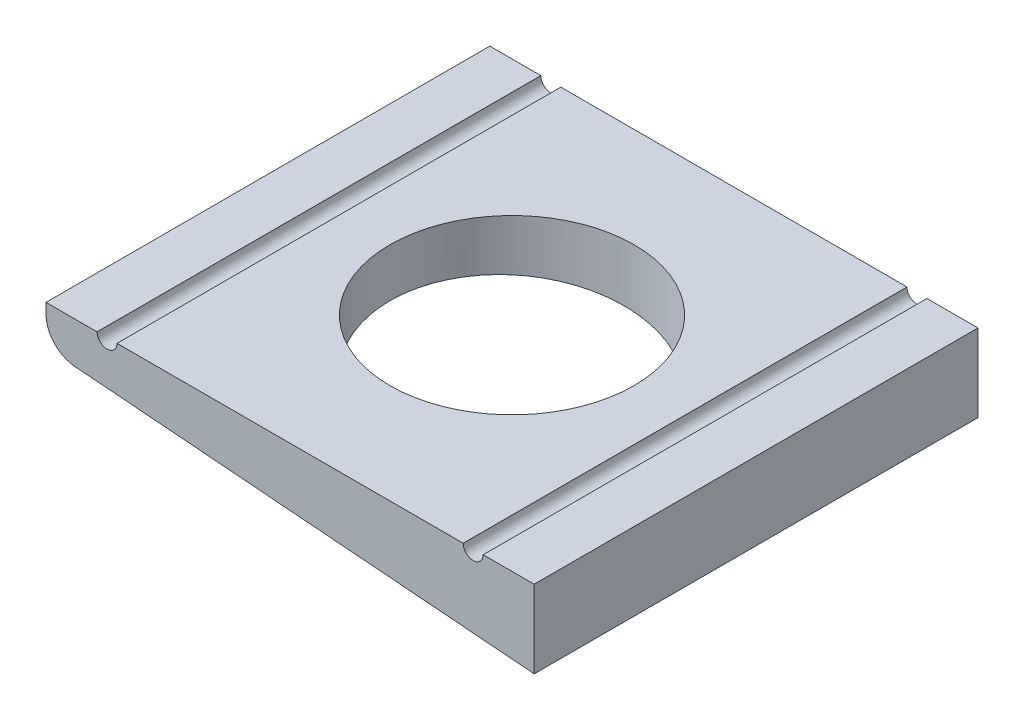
SolidWorks part; units mm, degrees
ref_plane "Plane1" through (0, 0, 0) normal (0, 0, 1) x (1, 0, 0)
ref_plane "Plane2" through (0, 0, 0) normal (0, 1, 0) x (1, 0, 0)
ref_plane "Plane3" through (0, 0, 0) normal (1, 0, 0) x (0, 0, -1)
sketch "Sketch1" plane through (0, 0, 0) normal (0, 0, 1) x (1, 0, 0)
  line L0 (22, 0) -> (-22, 0)
  line L1 (22, 0) -> (22, -7)
  line L2 (-22, 0) -> (-22, -0.9139)
  line L3 (22, -7) -> (-19.422, -3.7051)
  line L4 (0, 0) -> (0, -5.25) construction
  arc A0 (-19.422, -3.7051) -> (-22, -0.9139) centre (-19.2, -0.9139) cw
  dimension "R" = 2.8
  dimension "B" = 44
  dimension "D2" = 22
  dimension "H" = 7
  dimension "E" = 5.25
extrude "Base-Extrude" add sketch "Sketch1" along normal mid plane 40
sketch "Sketch2" plane through (0, 0, 0) normal (0, 1, 0) x (-1, 0, 0)
  circle A0 centre (0, 0) radius 11
  dimension "D" = 22
extrude "Cut-Extrude1" cut sketch "Sketch2" against normal through all
sketch "Sketch3" plane through (0, 0, 20) normal (0, 0, 1) x (1, 0, 0)
  line L0 (22, 0) -> (-22, 0) construction
  circle A0 centre (16.5, 0) radius 0.9
  circle A1 centre (-16.5, 0) radius 0.9
  dimension "D1" = 0.9
  dimension "T" = 0.9
  dimension "D2" = 16.5
  dimension "D3" = 16.5
extrude "ID-Grooves" cut sketch "Sketch3" against normal through all
equation "\"D2@Sketch1\" = \"B@Sketch1\" / 2"
equation "\"D2@Sketch3\" =  ( \"D@Sketch2\" / 2 )  +  ( \"B@Sketch1\" -  \"D@Sketch2\" )  / 4"
equation "\"D3@Sketch3\" = \"D2@Sketch3\""
equation "\"D1@Sketch3\" = \"T@Sketch3\""
